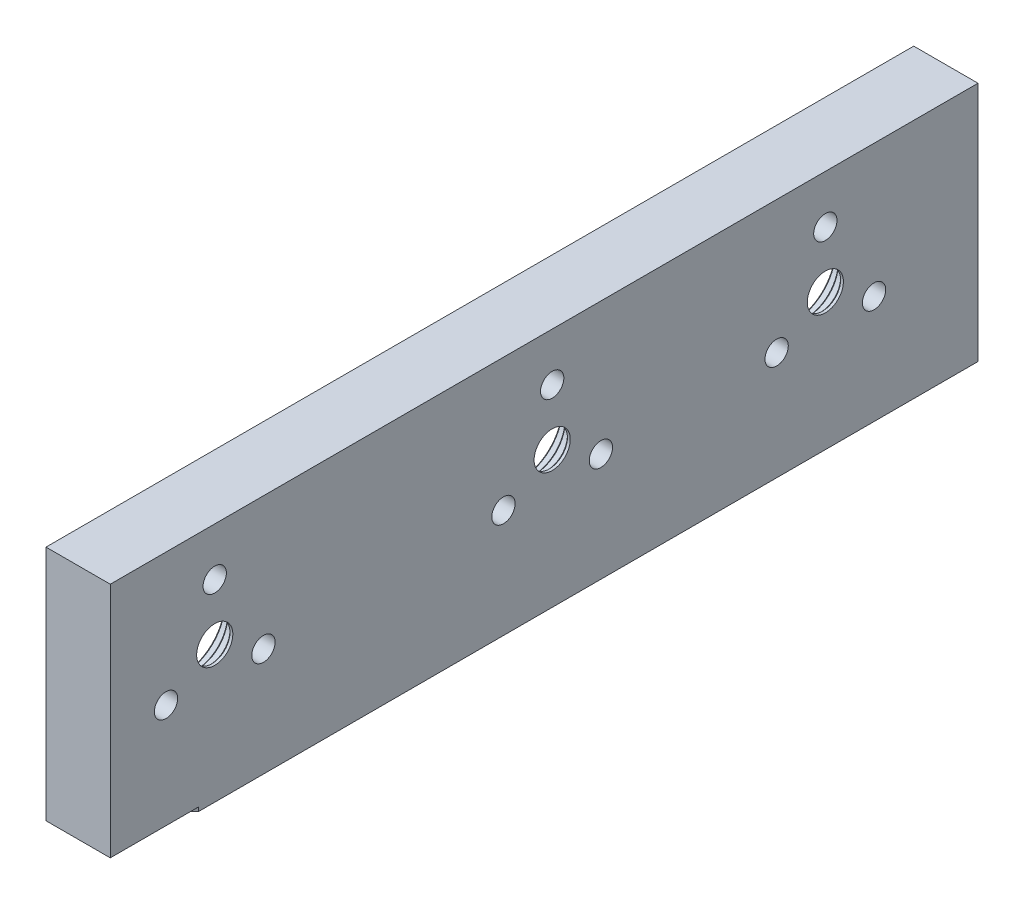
SolidWorks part; units mm, degrees
ref_plane "Front" through (0, 0, 0) normal (0, 0, 1) x (1, 0, 0)
ref_plane "Top" through (0, 0, 0) normal (0, 1, 0) x (1, 0, 0)
ref_plane "Right" through (0, 0, 0) normal (1, 0, 0) x (0, 0, -1)
sketch "Sketch1" plane through (0, 0, 0) normal (0, 1, 0) x (1, 0, 0)
  line L0 (0, 53) -> (0, 0) construction
  line L1 (-4, 53) -> (4, 53)
  line L2 (-4, 53) -> (-4, -55)
  line L3 (-4, -55) -> (4, -55)
  line L4 (4, 53) -> (4, -55)
  point P0 (0, 0)
  dimension "D1" = 8
  dimension "D2" = 53
  dimension "D3" = 55
extrude "Boss-Extrude1" add sketch "Sketch1" along normal blind 30
sketch "Sketch31" plane through (4, 0, 0) normal (1, 0, 0) x (0, 0, -1)
  circle A0 centre (0, 17) radius 9.5
  dimension "D1" = 19
  dimension "D2" = 17
extrude "Boss-Extrude3" add sketch "Sketch31" along normal blind 1
sketch "Sketch30" plane through (5, 0, 0) normal (1, 0, 0) x (0, 0, -1)
  circle A0 centre (0, 17) radius 4.1875
  circle A1 centre (0, 17) radius 9.5 construction
  dimension "D2" = 8.375
extrude "Boss-Extrude2" add sketch "Sketch30" along normal blind 2.4666
sketch "Sketch2" plane through (-4, 0, 0) normal (-1, 0, 0) x (0, 0, 1)
  circle A0 centre (0, 17) radius 11.25
  circle A1 centre (0, 17) radius 9.5 construction
  dimension "D2" = 22.5
extrude "Cut-Extrude1" cut sketch "Sketch2" against normal blind 4
sketch "Sketch3" plane through (0, 0, 0) normal (-1, 0, 0) x (0, 0, 1)
  circle A0 centre (0, 17) radius 5.004
  dimension "D1" = 10.008
extrude "Cut-Extrude2" cut sketch "Sketch3" against normal blind 1.6
sketch "Sketch28" plane through (1.6, 0, 0) normal (-1, 0, 0) x (0, 0, 1)
  circle A0 centre (0, 17) radius 3.75
  dimension "D1" = 7.5
extrude "Cut-Extrude10" cut sketch "Sketch28" against normal blind 1.8
sketch "Sketch29" plane through (3.4, 0, 0) normal (-1, 0, 0) x (0, 0, 1)
  circle A0 centre (0, 17) radius 2.25
  dimension "D1" = 4.5
extrude "Cut-Extrude11" cut sketch "Sketch29" against normal through all
sketch "Sketch32" plane through (4, 0, 0) normal (1, 0, 0) x (0, 0, -1)
  circle A0 centre (0, 17) radius 9.5 construction
  circle A1 centre (0, 17) radius 9.5
extrude "Cut-Extrude12" cut sketch "Sketch32" along normal through all
sketch "Sketch8" plane through (4, 0, 0) normal (1, 0, 0) x (0, 0, -1)
  line L0 (0, 17) -> (-6.0622, 13.5) construction
  line L1 (0, 17) -> (6.0622, 13.5) construction
  line L2 (0, 24) -> (0, 10) construction
  line L3 (0, 17) -> (0, 0) construction
  circle A0 centre (0, 17) radius 7 construction
  dimension "D1" = 14
  dimension "D2" = 60
  dimension "D3" = 60
  dimension "D4" = 17
hole_wizard "M2.5 Clearance Hole1" positions "Sketch9" profile "Sketch10" hole size "M2.5" standard "ANSI Metric"
sketch "Sketch9" plane through (4, 0, 0) normal (1, 0, 0) x (0, 0, -1)
  point P0 (0, 24)
  point P3 (6.0622, 13.5)
  point P6 (-6.0622, 13.5)
sketch "Sketch10" plane through (4, 24, 0) normal (0, 1, 0) x (0, 0, -1)
  line L0 (0, 0) -> (0, 8)
  line L1 (0, 8) -> (1.45, 8)
  line L2 (1.45, 8) -> (1.45, 0)
  line L5 (1.45, 0) -> (0, 0)
  line L11 (0, -6.35) -> (0, 107.95) construction
  dimension "Thru Hole Dia." = 2.9
  dimension "Thru Hole Depth" = 8
pattern_linear "LPattern1" count 2 spacing 34 along (0, 0, -1) count 2 spacing 42 along (0, 0, 1) of "Cut-Extrude1", "Cut-Extrude2", "M2.5 Clearance Hole1", "Cut-Extrude10", "Cut-Extrude11"
hole_wizard "M2.5x0.45 Tapped Hole1" positions "Sketch20" profile "Sketch21" tap size "M2.5x0.45" standard "ANSI Metric"
sketch "Sketch20" plane through (0, 0, 0) normal (0, -1, 0) x (-1, 0, 0)
  line L0 (0, 53) -> (0, -55) construction
  line L1 (-4, 53) -> (4, 53) construction
  line L3 (4, -55) -> (-4, -55) construction
  point P0 (0, 48)
  point P4 (0, 17)
  point P6 (0, -14)
  point P19 (0, -39)
  dimension "D1" = 48
  dimension "D3" = 14
  dimension "D4" = 17
  dimension "D7" = 39
sketch "Sketch21" plane through (0, 0, -48) normal (1, 0, 0) x (0, 0, -1)
  line L0 (0, 0) -> (0, 5.6159)
  line L1 (0, 5.6159) -> (1.025, 5)
  line L2 (1.025, 5) -> (1.025, 0)
  line L5 (1.025, 0) -> (0, 0)
  line L10 (0, 5.6159) -> (-1.025, 5) construction
  line L11 (0, -6.35) -> (0, 107.95) construction
  dimension "Tap Drill Dia." = 2.05
  dimension "Tap Drill Depth" = 5
  dimension "Drill Angle" = 118
sketch "Sketch27" plane through (0, 0, 0) normal (0, -1, 0) x (1, 0, 0)
  line L0 (4, 44) -> (4, 55)
  line L1 (4, 55) -> (4, -53) construction
  line L2 (4, 55) -> (-4, 55)
  line L4 (-4, 55) -> (-4, 52)
  line L5 (-4, -53) -> (-4, 55) construction
  line L6 (-4, 52) -> (4, 44)
  dimension "D1" = 11
  dimension "D2" = 45
extrude "Cut-Extrude9" cut sketch "Sketch27" against normal blind 0.5
chamfer "Chamfer1" distance 0.25 angle 45 12 edges at (0, 17, 5.004) (0, 17, 47.004) (0, 17, -28.996) (3.4, 17, 44.25) (1.6, 17, 45.75) (3.4, 17, 2.25) (1.6, 17, 3.75) (3.4, 17, -31.75) (1.6, 17, -30.25) (-4, 17, 53.25) (-4, 17, 11.25) (-4, 17, -22.75)
